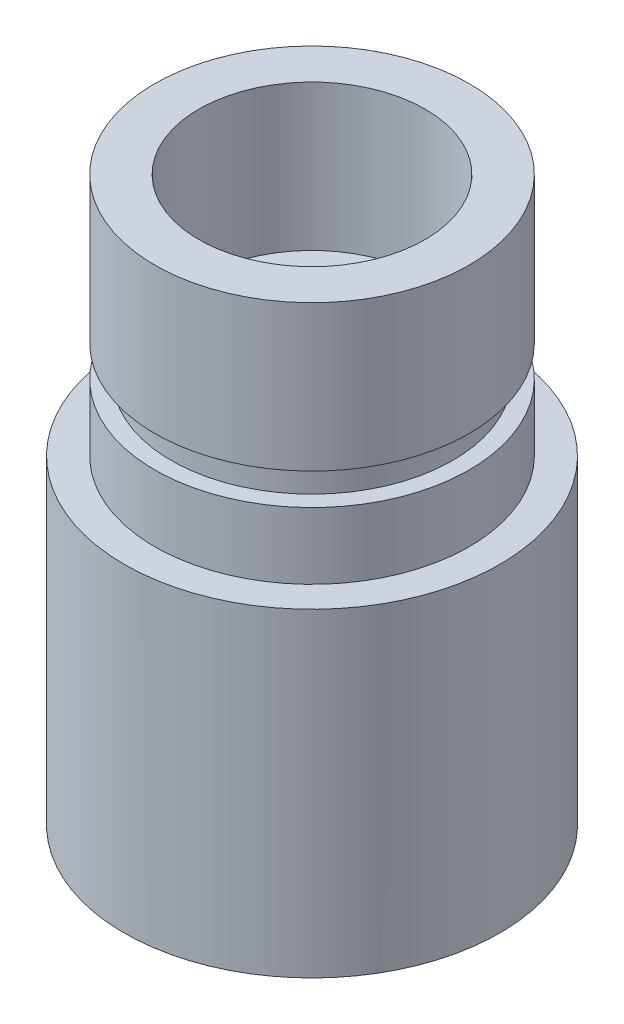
SolidWorks part; units mm, degrees
ref_plane "Front Plane" through (0, 0, 0) normal (0, 0, 1) x (1, 0, 0)
ref_plane "Top Plane" through (0, 0, 0) normal (0, 1, 0) x (1, 0, 0)
ref_plane "Right Plane" through (0, 0, 0) normal (1, 0, 0) x (0, 0, -1)
sketch "Sketch1" plane through (0, 0, 0) normal (0, 0, 1) x (1, 0, 0)
  line L0 (0, 0) -> (0, 61.3981) construction
  line L1 (-7.3, 0) -> (-12.7, 0)
  line L2 (-12.7, 0) -> (-12.7, 21.6)
  line L3 (-12.7, 21.6) -> (-10.635, 21.6)
  line L4 (-10.635, 21.6) -> (-10.635, 26.1)
  line L5 (-10.635, 38.1) -> (-7.65, 38.1)
  line L6 (-7.65, 38.1) -> (-7.65, 28.2336)
  line L7 (-7.65, 28.2336) -> (-2, 28.2336)
  line L8 (-2, 28.2336) -> (-2, 24)
  line L9 (-2, 24) -> (-7.3, 24)
  line L10 (-7.3, 24) -> (-7.3, 0)
  line L11 (-10.635, 28.2336) -> (-10.635, 38.1)
  line L12 (-10.635, 28.2336) -> (-9.525, 28.2336)
  line L14 (-10.635, 26.1) -> (-9.525, 26.1)
  line L15 (-9.525, 28.2336) -> (-9.525, 26.1)
  dimension "D5" = 2.1336
  dimension "D1" = 21.6
  dimension "D2" = 25.4
  dimension "D3" = 5.4
  dimension "D4" = 16.5
  dimension "D6" = 19.05
  dimension "D7" = 21.27
  dimension "D9" = 15.3
  dimension "D10" = 4
  dimension "D11" = 24
revolve "Revolve1" add sketch "Sketch1" angle 360 about L0
sketch "Sketch2" plane through (0, 0, 0) normal (1, 0, 0) x (0, 0, -1)
  line L0 (-12.7, 0) -> (12.7, 0) construction
  line L1 (3.175, 0) -> (-3.175, 0)
  line L2 (3.175, 0) -> (3.175, 9.525)
  line L3 (3.175, 9.525) -> (-3.175, 9.525) construction
  line L4 (-3.175, 0) -> (-3.175, 9.525)
  arc A0 (-3.175, 9.525) -> (3.175, 9.525) centre (0, 9.525) cw
  point P6 (0, 0)
  dimension "D1" = 6.35
extrude "Cut-Extrude1" cut sketch "Sketch2" against normal up to next
sketch "Sketch3" plane through (0, 0, 0) normal (0, 0, 1) x (1, 0, 0)
  line L0 (0, 0) -> (0, 55.1) construction
  line L2 (0, 28.2336) -> (0.875, 28.2336)
  line L3 (0, 28.2336) -> (0, 55.1)
  line L4 (0, 55.1) -> (7.65, 55.1)
  line L5 (7.65, 28.2336) -> (7.65, 55.1)
  line L7 (7.65, 28.2336) -> (-7.65, 28.2336) construction
  line L8 (7.65, 28.2336) -> (2, 28.2336) construction
  line L9 (-2, 24) -> (2, 24) construction
  line L10 (-2, 24) -> (2, 24) construction
  line L11 (2, 24) -> (2, 28.2336)
  line L12 (2, 24) -> (1.625, 14.5)
  line L13 (1.625, 14.5) -> (0.875, 14.5)
  line L14 (0.875, 14.5) -> (0.875, 28.2336)
  line L15 (2, 28.2336) -> (7.65, 28.2336)
  line L16 (0.875, 28.2336) -> (-7.65, 28.2336) construction
  line L17 (7.65, 38.1) -> (-7.65, 38.1) construction
  line L18 (7.65, 38.1) -> (-7.65, 38.1) construction
  dimension "D1" = 9.5
  dimension "D2" = 1.75
  dimension "D3" = 0.75
  dimension "D4" = 17
revolve "Revolve2" [suppressed] add sketch "Sketch3" angle 360 about L0
